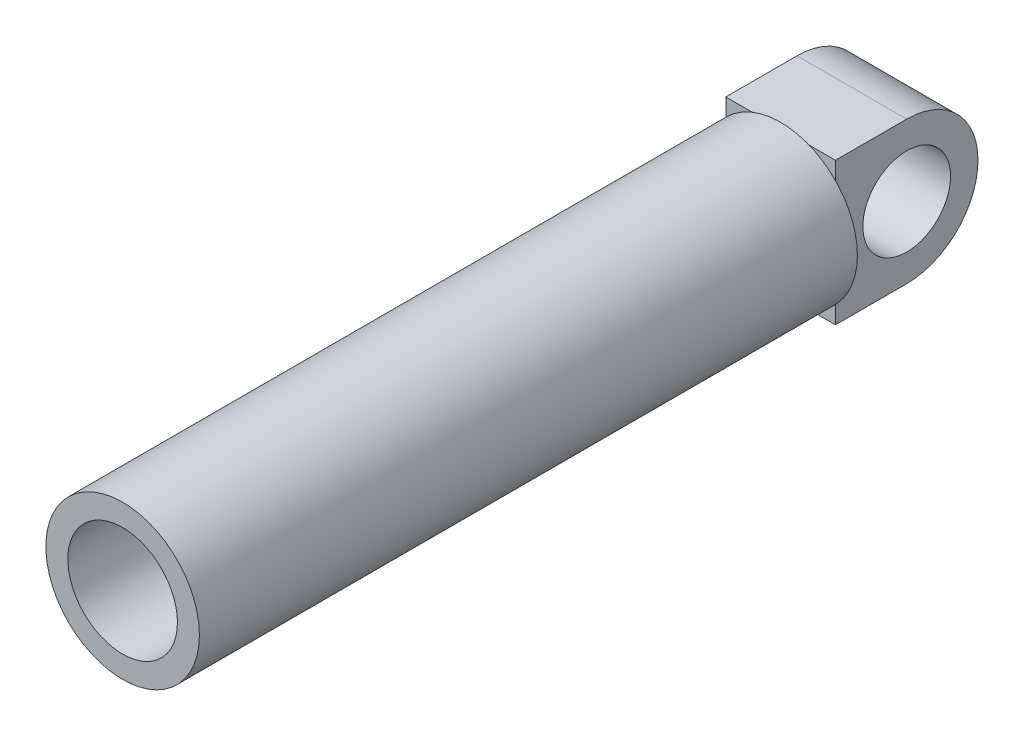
SolidWorks part; units mm, degrees
ref_plane "Front Plane" through (0, 0, 0) normal (0, 0, 1) x (1, 0, 0)
ref_plane "Top Plane" through (0, 0, 0) normal (0, 1, 0) x (1, 0, 0)
ref_plane "Right Plane" through (0, 0, 0) normal (1, 0, 0) x (0, 0, -1)
sketch "Sketch1" plane through (0, 0, 0) normal (1, 0, 0) x (0, 0, -1)
  line L0 (0, 65) -> (-65, 65)
  line L2 (-65, 65) -> (-65, -65)
  line L3 (-65, -65) -> (0, -65)
  circle A0 centre (0, 0) radius 40
  circle A1 centre (0, 0) radius 65
  dimension "D1" = 80
  dimension "D2" = 130
extrude "Boss-Extrude1" add sketch "Sketch1" along normal mid plane 100
sketch "Sketch2" plane through (0, 0, 65) normal (0, 0, 1) x (1, 0, 0)
  circle A0 centre (0, 0) radius 70
  circle A1 centre (0, 0) radius 50
  dimension "D1" = 140
  dimension "D2" = 100
extrude "Boss-Extrude3" add sketch "Sketch2" along normal blind 600 separate body
